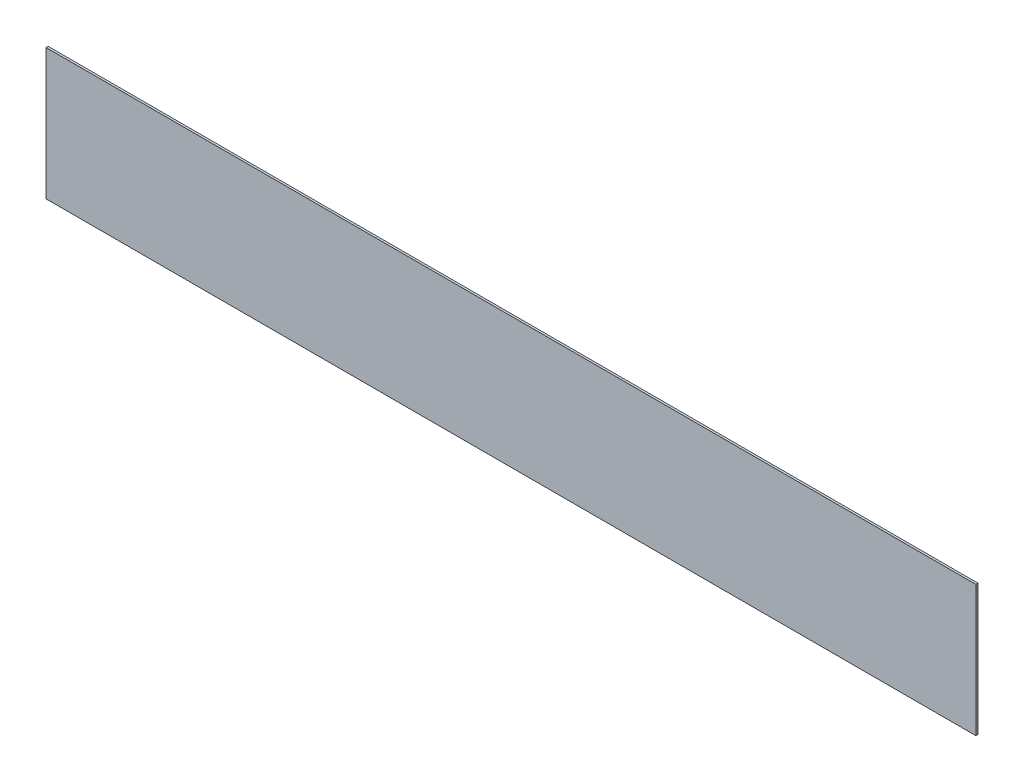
SolidWorks part; units mm, degrees
ref_plane "Plan de face" through (0, 0, 0) normal (0, 0, 1) x (1, 0, 0)
ref_plane "Plan de dessus" through (0, 0, 0) normal (0, 1, 0) x (1, 0, 0)
ref_plane "Plan de droite" through (0, 0, 0) normal (1, 0, 0) x (0, 0, -1)
sketch "Esquisse1" plane through (0, 0, 0) normal (0, 0, 1) x (1, 0, 0)
  line L1 (0, 0) -> (220, 0)
  line L2 (0, 0) -> (0, 31)
  line L3 (0, 31) -> (220, 31)
  line L4 (220, 0) -> (220, 31)
  dimension "D1" = 220
  dimension "D2" = 31
extrude "Extrusion1" add sketch "Esquisse1" along normal blind 0.5
